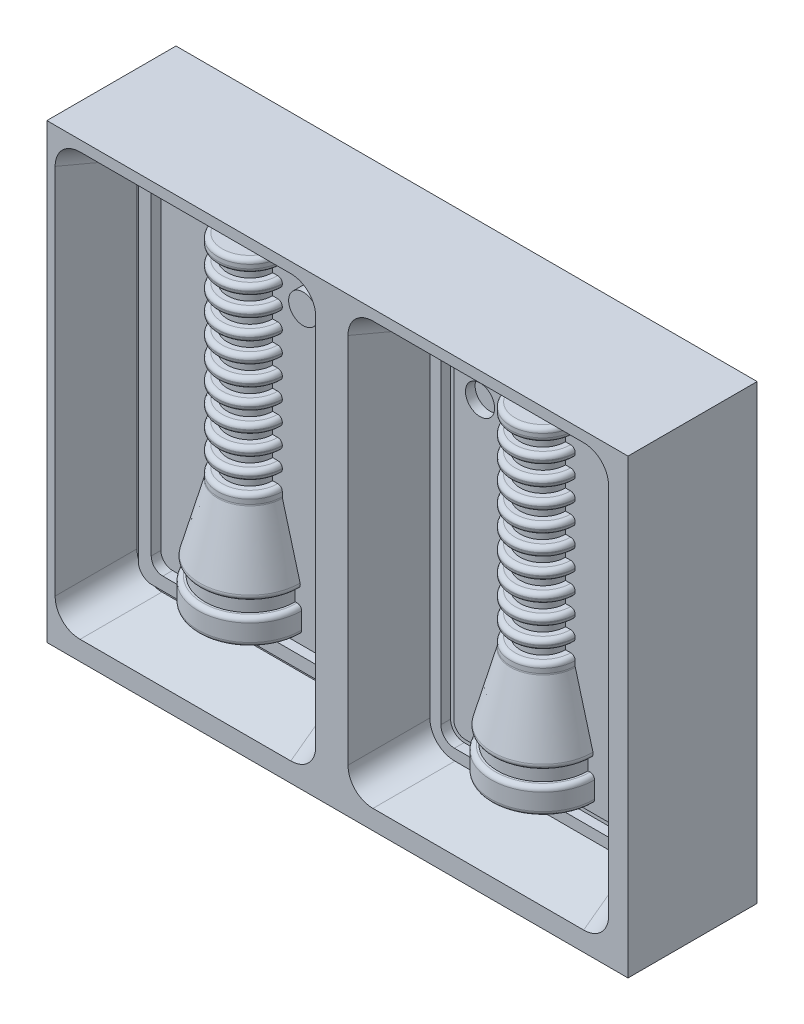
SolidWorks part; units mm, degrees
ref_plane "Front Plane" through (0, 0, 0) normal (0, 0, 1) x (1, 0, 0)
ref_plane "Top Plane" through (0, 0, 0) normal (0, 1, 0) x (1, 0, 0)
ref_plane "Right Plane" through (0, 0, 0) normal (1, 0, 0) x (0, 0, -1)
sketch "Sketch1" plane through (0, 0, 0) normal (0, 0, 1) x (1, 0, 0)
  line L1 (71.2154, -15.8052) -> (-18.7846, -15.8052)
  line L2 (71.2154, -15.8052) -> (71.2154, 54.1948)
  line L3 (71.2154, 54.1948) -> (-18.7846, 54.1948)
  line L4 (-18.7846, -15.8052) -> (-18.7846, 54.1948)
  dimension "D1" = 90
  dimension "D2" = 70
extrude "Boss-Extrude1" add sketch "Sketch1" against normal blind 20 contours L4 L3 L2 L1
other "Cavity1"
other "small_mold_a<1>@smalltocnc1"
other "small_Mold_b^negative_mold<1>@smalltocnc1"
fillet "Fillet1" radius 4 8 edges at (29.1962, 51.2141, -5) (-16.1628, -11.4654, -5) (29.1962, -11.4654, -5) (21.5167, -11.4654, -5) (66.8757, -11.4654, -5) (-16.1628, 51.2141, -5) (21.5167, 51.2141, -5) (66.8757, 51.2141, -5)
